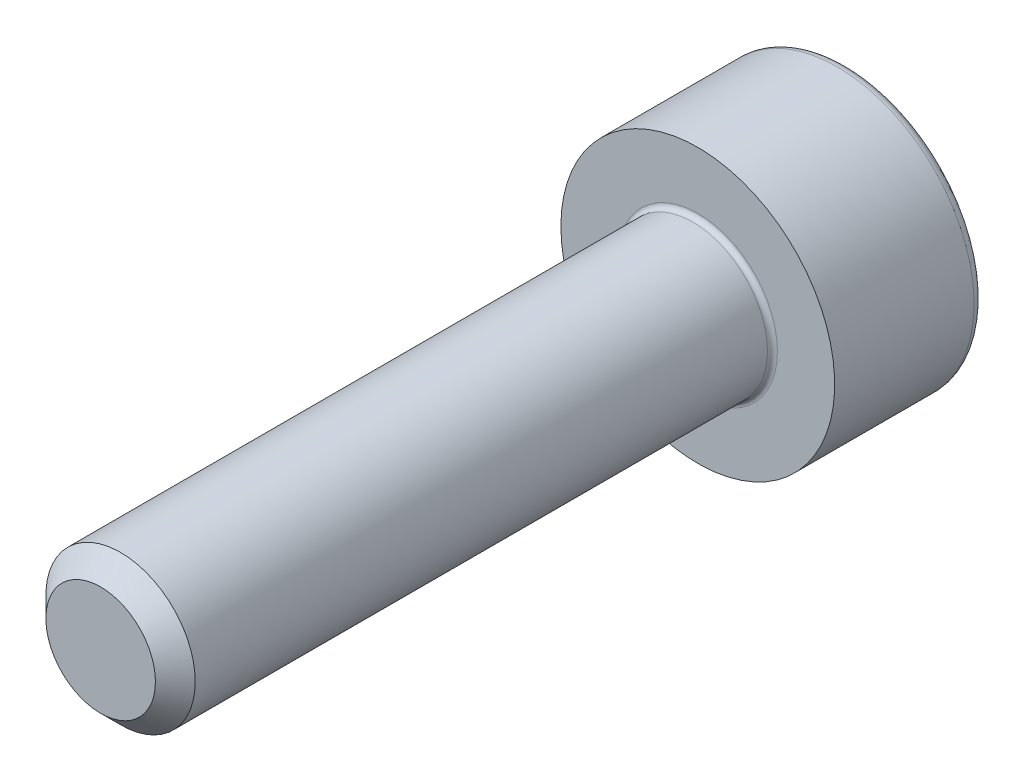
SolidWorks part; units mm, degrees
ref_plane "Alzado" through (0, 0, 0) normal (0, 0, 1) x (1, 0, 0)
ref_plane "Planta" through (0, 0, 0) normal (0, 1, 0) x (1, 0, 0)
ref_plane "Vista lateral" through (0, 0, 0) normal (1, 0, 0) x (0, 0, -1)
ref_plane "Plano1" through (0, -5639.902, 0) normal (0, -1, 0) x (1, 0, 0)
sketch "Croquis1" plane through (0, -5639.902, 0) normal (0, -1, 0) x (1, 0, 0)
  line L0 (14697.9755, -590) -> (14695.2255, -590)
  line L1 (14695.2255, -590) -> (14695.2255, -593)
  line L2 (14695.2255, -593) -> (14697.9755, -593)
  line L3 (14697.9755, -593) -> (14697.9755, -590)
  line L4 (14695.2255, -590) -> (14695.2255, -593) construction
revolve "Revolución1" add sketch "Croquis1" angle 360 about L4
sketch "Croquis2" plane through (0, 0, -590) normal (0, 0, 1) x (1, 0, 0)
  circle A0 centre (14695.2255, -5639.902) radius 1.5
extrude "Saliente-Extruir1" add sketch "Croquis2" along normal blind 11.995
sketch "Croquis3" plane through (0, 0, -593) normal (0, 0, -1) x (-1, 0, 0)
  line L0 (-14694.5038, -5638.652) -> (-14695.9472, -5638.652)
  line L1 (-14695.9472, -5638.652) -> (-14696.6689, -5639.902)
  line L2 (-14696.6689, -5639.902) -> (-14695.9472, -5641.152)
  line L3 (-14695.9472, -5641.152) -> (-14694.5038, -5641.152)
  line L4 (-14694.5038, -5641.152) -> (-14693.7822, -5639.902)
  line L5 (-14693.7822, -5639.902) -> (-14694.5038, -5638.652)
extrude "Cortar-Extruir1" cut sketch "Croquis3" against normal blind 1.5
chamfer "Chaflán1" distance 0.4 angle 45 1 edges at (14696.7255, -5639.902, -578.005)
fillet "Redondeo1" radius 0.1 1 edges at (14696.7255, -5639.902, -590)
fillet "Redondeo2" radius 0.2 1 edges at (14692.4755, -5639.902, -593)
